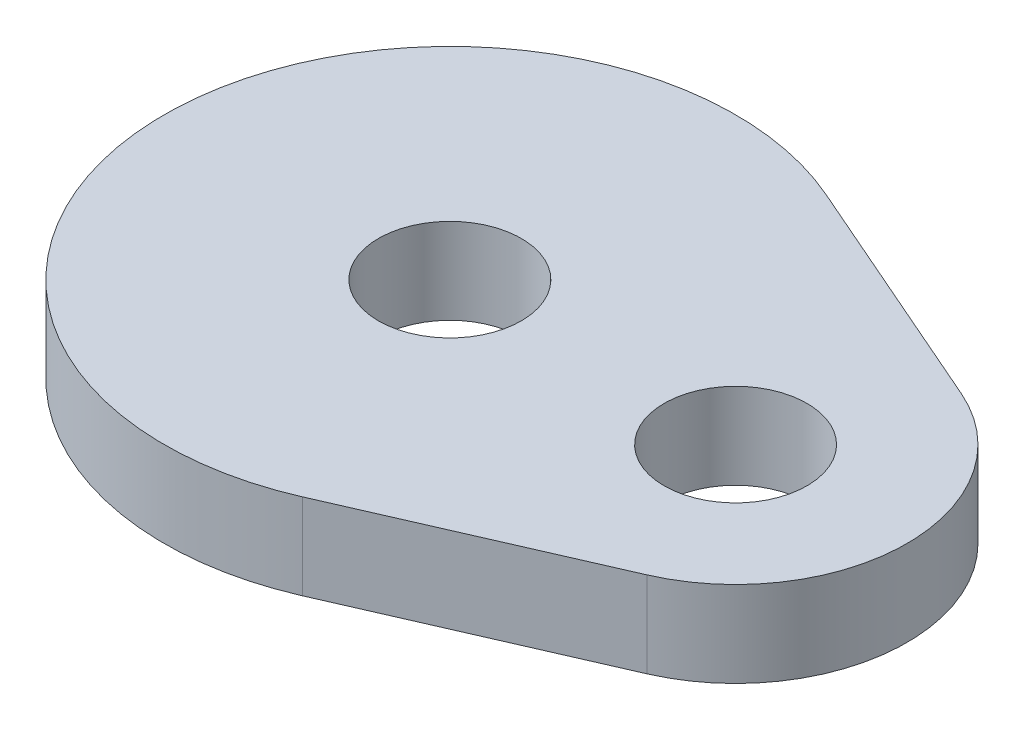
SolidWorks part; units mm, degrees
ref_plane "Front" through (0, 0, 0) normal (0, 0, 1) x (1, 0, 0)
ref_plane "Top" through (0, 0, 0) normal (0, 1, 0) x (1, 0, 0)
ref_plane "Right" through (0, 0, 0) normal (1, 0, 0) x (0, 0, -1)
sketch "Sketch1" plane through (0, 0, 0) normal (0, 1, 0) x (1, 0, 0)
  line L1 (4, 9.1652) -> (12.4, 5.4991)
  line L2 (4, -9.1652) -> (12.4, -5.4991)
  circle A0 centre (0, 0) radius 2.5
  circle A1 centre (10, 0) radius 2.5
  arc A2 (4, 9.1652) -> (4, -9.1652) centre (0, 0) ccw
  arc A5 (12.4, -5.4991) -> (12.4, 5.4991) centre (10, 0) ccw
extrude "Extrude1" add sketch "Sketch1" along normal blind 3
